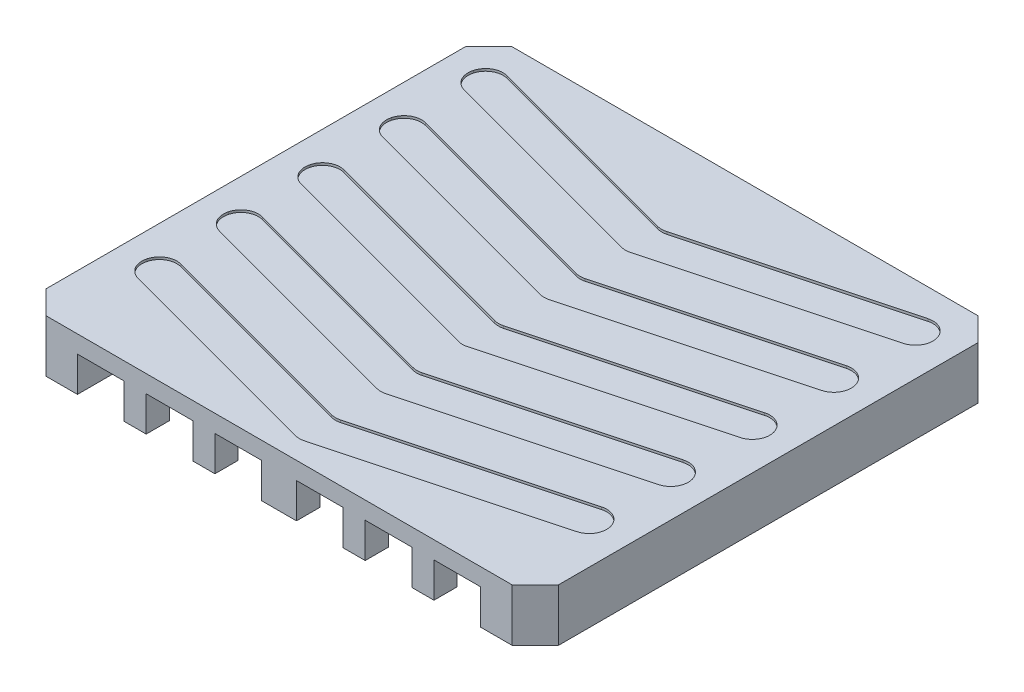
SolidWorks part; units mm, degrees
ref_plane "前视基准面" through (0, 0, 0) normal (0, 0, 1) x (1, 0, 0)
ref_plane "上视基准面" through (0, 0, 0) normal (0, 1, 0) x (1, 0, 0)
ref_plane "右视基准面" through (0, 0, 0) normal (1, 0, 0) x (0, 0, -1)
sketch "草图1" plane through (0, 0, 0) normal (0, 1, 0) x (1, 0, 0)
  line L0 (-38.5609, 0) -> (35.1038, 0) construction
  line L1 (0, 61.5645) -> (0, -41.0874) construction
  line L3 (-22, 20) -> (22, 20)
  line L4 (-22, 20) -> (-22, -20)
  line L5 (-22, -20) -> (22, -20)
  line L6 (22, 20) -> (22, -20)
  line L7 (-22, 20) -> (22, -20) construction
  line L8 (-22, -20) -> (22, 20) construction
  point P5 (0, 0)
  dimension "D1" = 44
  dimension "D2" = 40
extrude "凸台-拉伸1" add sketch "草图1" along normal blind 4.5
chamfer "倒角1" distance 2 angle 45 4 edges at (-22, 2.25, -20) (22, 2.25, -20) (22, 2.25, 20) (-22, 2.25, 20)
sketch "草图2" plane through (0, 0, 0) normal (0, -1, 0) x (1, 0, 0)
  line L0 (-26.6072, 0) -> (29.6093, 0) construction
  line L1 (0, 21.5153) -> (0, -22.2217) construction
  line L4 (-20, 18) -> (20, 18)
  line L5 (-17.3, 18) -> (17.3, 18)
  line L6 (-1.5, 10) -> (-1.5, -10)
  line L7 (20, -18) -> (-20, -18)
  line L8 (17.3, -18) -> (-17.3, -18)
  line L9 (1.5, 10) -> (1.5, -10)
  line L10 (-17.3, 18) -> (-17.3, -18)
  line L11 (17.3, 18) -> (17.3, -18)
  line L12 (-1.5, 10) -> (1.5, 10)
  line L13 (-1.5, -10) -> (1.5, -10)
  line L14 (-26.6072, 10) -> (29.6093, 10) construction
  line L15 (-26.6072, -10) -> (29.6093, -10) construction
  line L16 (-17.3, 21.5153) -> (-17.3, -22.2217) construction
  line L17 (17.3, 21.5153) -> (17.3, -22.2217) construction
  line L18 (1.5, 21.5153) -> (1.5, -22.2217) construction
  line L19 (-1.5, 21.5153) -> (-1.5, -22.2217) construction
  dimension "D1" = 2
  dimension "D2" = 2
  dimension "D3" = 1.5
  dimension "D4" = 1.5
  dimension "D5" = 15.8
  dimension "D6" = 15.8
  dimension "D7" = 10
  dimension "D8" = 10
extrude "切除-拉伸1" cut sketch "草图2" against normal blind 3
sketch "草图3" plane through (0, 0, 0) normal (0, -1, 0) x (1, 0, 0)
  line L0 (-31.8657, 0) -> (28.4725, 0) construction
  line L1 (0, 25.2743) -> (0, -28.2052) construction
  line L2 (-20, 20) -> (20, 20) construction
  line L3 (-17.3, -18) -> (17.3, -18) construction
  line L4 (-17.3, 20) -> (-13.3, 20)
  line L5 (17.3, 18) -> (-17.3, 18) construction
  line L6 (-1.5, 20) -> (-1.5, 18)
  line L7 (-5.5, 20) -> (-5.5, 18)
  line L8 (-7.4, 20) -> (-7.4, 18)
  line L9 (-11.4, 20) -> (-11.4, 18)
  line L10 (-13.3, 20) -> (-13.3, 18)
  line L11 (-17.3, 18) -> (-17.3, -18) construction
  line L13 (-11.4, 20) -> (-7.4, 20)
  line L14 (-13.3, 18) -> (-17.3, 18)
  line L15 (-5.5, 20) -> (-1.5, 20)
  line L16 (-7.4, 18) -> (-11.4, 18)
  line L17 (1.5, 18) -> (5.5, 18)
  line L18 (-1.5, 18) -> (-5.5, 18)
  line L19 (-1.5, 25.2743) -> (-1.5, -28.2052) construction
  line L20 (-5.5, 25.2743) -> (-5.5, -28.2052) construction
  line L21 (-7.4, 25.2743) -> (-7.4, -28.2052) construction
  line L22 (-11.4, 25.2743) -> (-11.4, -28.2052) construction
  line L23 (-13.3, 25.2743) -> (-13.3, -28.2052) construction
  line L24 (7.4, 18) -> (11.4, 18)
  line L25 (5.5, 20) -> (1.5, 20)
  line L26 (13.3, 18) -> (17.3, 18)
  line L27 (11.4, 20) -> (7.4, 20)
  line L28 (13.3, 20) -> (13.3, 18)
  line L29 (11.4, 20) -> (11.4, 18)
  line L30 (7.4, 20) -> (7.4, 18)
  line L31 (5.5, 20) -> (5.5, 18)
  line L32 (1.5, 20) -> (1.5, 18)
  line L33 (17.3, 20) -> (13.3, 20)
  line L34 (-17.3, 20) -> (-17.3, 18)
  line L35 (17.3, 20) -> (17.3, 18)
  line L37 (-3.7, -18) -> (-1.5, -18)
  line L38 (-3.7, -18) -> (-3.7, -20)
  line L39 (-3.7, -20) -> (-1.5, -20)
  line L40 (-1.5, -18) -> (-1.5, -20)
  line L41 (20, -20) -> (-20, -20) construction
  line L42 (-17.3, -18) -> (17.3, -18) construction
  line L43 (-10.65, -18) -> (-8.15, -18)
  line L44 (-10.65, -18) -> (-10.65, -20)
  line L45 (-10.65, -20) -> (-8.15, -20)
  line L46 (-8.15, -18) -> (-8.15, -20)
  line L47 (-17.3, 18) -> (-17.3, -18) construction
  line L48 (-17.3, -18) -> (-15.1, -18)
  line L49 (-17.3, -18) -> (-17.3, -20)
  line L50 (-17.3, -20) -> (-15.1, -20)
  line L51 (-15.1, -18) -> (-15.1, -20)
  line L52 (15.1, -18) -> (15.1, -20)
  line L53 (17.3, -20) -> (15.1, -20)
  line L54 (17.3, -18) -> (17.3, -20)
  line L55 (17.3, -18) -> (15.1, -18)
  line L56 (8.15, -18) -> (8.15, -20)
  line L57 (10.65, -20) -> (8.15, -20)
  line L58 (10.65, -18) -> (10.65, -20)
  line L59 (10.65, -18) -> (8.15, -18)
  line L60 (1.5, -18) -> (1.5, -20)
  line L61 (3.7, -20) -> (1.5, -20)
  line L62 (3.7, -18) -> (3.7, -20)
  line L63 (3.7, -18) -> (1.5, -18)
  dimension "D6" = 2.2
  dimension "D7" = 1.5
  dimension "D8" = 2.5
  dimension "D9" = 2.2
  dimension "D10" = 8.15
  dimension "D1" = 1.5
  dimension "D2" = 5.5
  dimension "D3" = 7.4
  dimension "D4" = 11.4
  dimension "D5" = 13.3
extrude "切除-拉伸2" cut sketch "草图3" against normal blind 3
sketch "草图4" plane through (0, 0, 0) normal (0, -1, 0) x (1, 0, 0)
  line L0 (22, 18) -> (22, -18) construction
  line L1 (-22, -18) -> (-22, 18) construction
  circle A0 centre (19.3, 15) radius 1
  circle A1 centre (19.3, -12) radius 1
  circle A2 centre (-19.3, 15) radius 1
  circle A3 centre (-19.3, -12) radius 1
  dimension "D5" = 2
  dimension "D1" = 15
  dimension "D2" = 12
  dimension "D3" = 2.7
  dimension "D4" = 2.7
extrude "切除-拉伸3" cut sketch "草图4" against normal blind 3.5
sketch "草图5" plane through (0, 4.5, 0) normal (0, 1, 0) x (1, 0, 0)
  line L0 (28.7596, 0) -> (-31.1743, 0) construction
  line L1 (0, -30.5378) -> (0, 23.9974) construction
  line L2 (0, -18.3112) -> (20.2844, -12.876)
  line L3 (20.2844, -12.876) -> (19.508, -9.9782)
  line L4 (19.508, -9.9782) -> (0, -15.2054)
  line L5 (-20, -20) -> (20, -20) construction
  line L6 (-20.2844, -12.876) -> (-19.508, -9.9782)
  line L7 (-19.508, -9.9782) -> (0, -15.2054)
  line L8 (0, -18.3112) -> (-20.2844, -12.876)
  line L9 (19.508, -2.9782) -> (0, -8.2054)
  line L10 (0, -11.3112) -> (20.2844, -5.876)
  line L11 (0, -11.3112) -> (-20.2844, -5.876)
  line L12 (-19.508, -2.9782) -> (0, -8.2054)
  line L13 (-20.2844, -5.876) -> (-19.508, -2.9782)
  line L14 (20.2844, -5.876) -> (19.508, -2.9782)
  line L15 (19.508, 4.0218) -> (0, -1.2054)
  line L16 (0, -4.3112) -> (20.2844, 1.124)
  line L17 (0, -4.3112) -> (-20.2844, 1.124)
  line L18 (-19.508, 4.0218) -> (0, -1.2054)
  line L19 (-20.2844, 1.124) -> (-19.508, 4.0218)
  line L20 (20.2844, 1.124) -> (19.508, 4.0218)
  line L21 (19.508, 11.0218) -> (0, 5.7946)
  line L22 (0, 2.6888) -> (20.2844, 8.124)
  line L23 (0, 2.6888) -> (-20.2844, 8.124)
  line L24 (-19.508, 11.0218) -> (0, 5.7946)
  line L25 (-20.2844, 8.124) -> (-19.508, 11.0218)
  line L26 (20.2844, 8.124) -> (19.508, 11.0218)
  line L27 (19.508, 18.0218) -> (0, 12.7946)
  line L28 (0, 9.6888) -> (20.2844, 15.124)
  line L29 (0, 9.6888) -> (-20.2844, 15.124)
  line L30 (-19.508, 18.0218) -> (0, 12.7946)
  line L31 (-20.2844, 15.124) -> (-19.508, 18.0218)
  line L32 (20.2844, 15.124) -> (19.508, 18.0218)
  dimension "D1" = 15
  dimension "D2" = 3
  dimension "D3" = 21
  dimension "D4" = 5
extrude "切除-拉伸4" cut sketch "草图5" against normal blind 0.2
fillet "圆角3" radius 1.5 30 edges at (-20.2844, 4.4, -15.124) (-19.508, 4.4, -18.0218) (-20.2844, 4.4, 12.876) (-19.508, 4.4, 9.9782) (-20.2844, 4.4, 5.876) (-19.508, 4.4, 2.9782) (-20.2844, 4.4, -1.124) (-19.508, 4.4, -4.0218) (-20.2844, 4.4, -8.124) (-19.508, 4.4, -11.0218) (0, 4.4, -9.6888) (0, 4.4, -12.7946) (0, 4.4, -5.7946) (0, 4.4, -2.6888) (0, 4.4, 1.2054) (0, 4.4, 4.3112) (0, 4.4, 11.3112) (0, 4.4, 8.2054) (0, 4.4, 15.2054) (0, 4.4, 18.3112) (20.2844, 4.4, 12.876) (19.508, 4.4, 9.9782) (19.508, 4.4, 2.9782) (20.2844, 4.4, 5.876) (20.2844, 4.4, -1.124) (19.508, 4.4, -4.0218) (19.508, 4.4, -11.0218) (20.2844, 4.4, -8.124) (20.2844, 4.4, -15.124) (19.508, 4.4, -18.0218)
